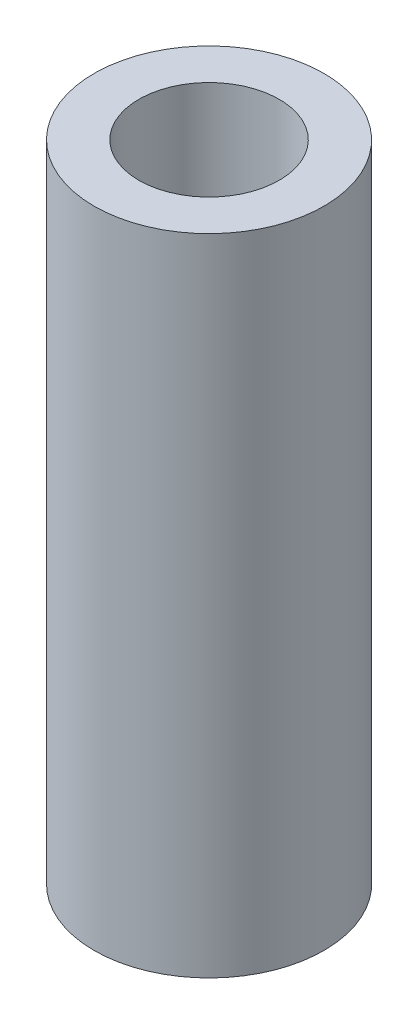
SolidWorks part; units mm, degrees
ref_plane "Front Plane" through (0, 0, 0) normal (0, 0, 1) x (1, 0, 0)
ref_plane "Top Plane" through (0, 0, 0) normal (0, 1, 0) x (1, 0, 0)
ref_plane "Right Plane" through (0, 0, 0) normal (1, 0, 0) x (0, 0, -1)
sketch "Sketch1" plane through (0, 0, 0) normal (0, 1, 0) x (1, 0, 0)
  circle A0 centre (0, 0) radius 4.0767
  circle A1 centre (0, 0) radius 2.4892
  dimension "D1" = 4.9784
  dimension "D2" = 1.5875
extrude "Boss-Extrude1" add sketch "Sketch1" along normal mid plane 22.86
